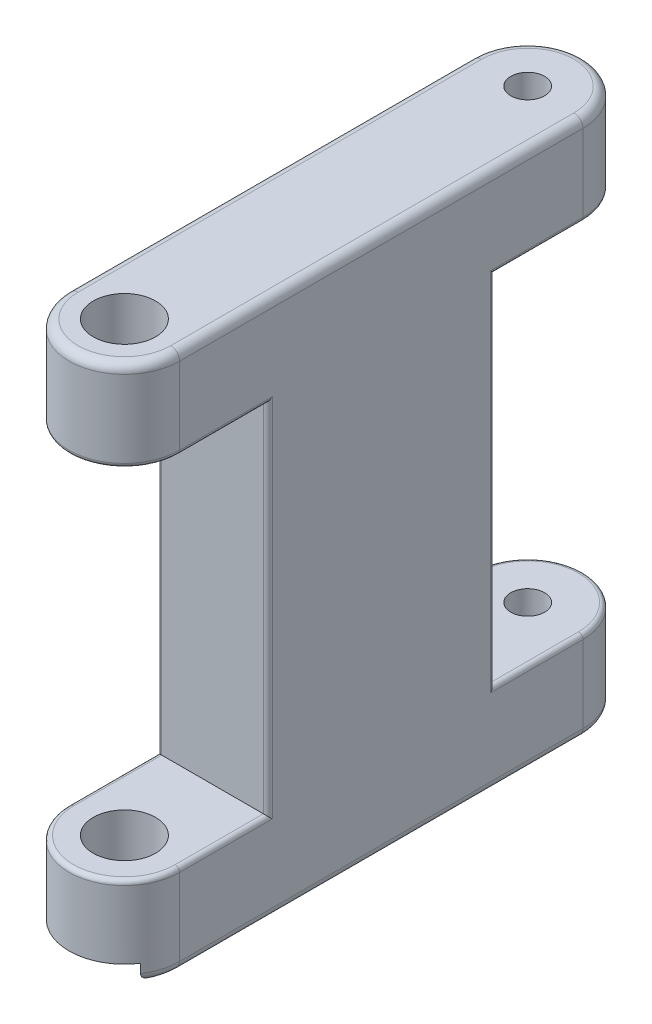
SolidWorks part; units mm, degrees
ref_plane "Front Plane" through (0, 0, 0) normal (0, 0, 1) x (1, 0, 0)
ref_plane "Top Plane" through (0, 0, 0) normal (0, 1, 0) x (1, 0, 0)
ref_plane "Right Plane" through (0, 0, 0) normal (1, 0, 0) x (0, 0, -1)
sketch "Sketch1" plane through (0, 0, 0) normal (0, 1, 0) x (1, 0, 0)
  line L0 (0, 0) -> (0, -45) construction
  line L1 (6.1688, 0) -> (6.1688, -45)
  line L2 (-6.1688, 0) -> (-6.1688, -45)
  arc A0 (6.1688, 0) -> (-6.1688, 0) centre (0, 0) ccw
  arc A1 (-6.1688, -45) -> (6.1688, -45) centre (0, -45) ccw
  point P3 (0, -22.5)
extrude "Boss-Extrude1" add sketch "Sketch1" along normal blind 60
fillet "Fillet1" radius 1 8 edges at (-6.1688, 0, 22.5) (0, 0, 51.1688) (6.1688, 0, 22.5) (0, 0, -6.1688) (6.1688, 60, 22.5) (0, 60, 51.1688) (-6.1688, 60, 22.5) (0, 60, -6.1688)
sketch "Sketch3" plane through (0, 0, 0) normal (0, -1, 0) x (1, 0, 0)
  line L0 (-5.1688, 40.9305) -> (-2.75, 20)
  line L1 (-2.75, 20) -> (2.75, 20)
  line L2 (2.75, 20) -> (5.1688, 40.9305)
  line L3 (5.1688, 45) -> (6.1688, 45) construction
  line L4 (5.1688, 40.9305) -> (5.1688, 52.629)
  line L5 (5.1688, 52.629) -> (-5.1688, 52.629)
  line L6 (-5.1688, 52.629) -> (-5.1688, 40.9305)
  line L7 (5.1688, 0) -> (5.1688, 45) construction
  dimension "D1" = 25
  dimension "D2" = 5.5
extrude "servomount" cut sketch "Sketch3" against normal blind 2
sketch "Sketch4" plane through (0, 60, 0) normal (0, 1, 0) x (1, 0, 0)
  circle A0 centre (0, 0) radius 1.8875
  circle A1 centre (0, -45) radius 3.475
extrude "holes" cut sketch "Sketch4" against normal through all
sketch "Sketch2" plane through (-6.1688, 0, 0) normal (-1, 0, 0) x (0, 0, 1)
  line L0 (0, 60) -> (45, 60) construction
  line L1 (-13.1259, 49.9) -> (9.8312, 49.9)
  line L2 (-13.1259, 49.9) -> (-13.1259, 10.1)
  line L3 (-13.1259, 10.1) -> (9.8312, 10.1)
  line L4 (9.8312, 49.9) -> (9.8312, 10.1)
  line L5 (0, 0) -> (45, 0) construction
  line L6 (-6.1688, 59) -> (-6.1688, 1) construction
  line L7 (22.5, 0) -> (22.5, 60) construction
  line L8 (0, 60) -> (45, 60) construction
  line L9 (35.1688, 49.9) -> (35.1688, 10.1)
  line L10 (58.1259, 10.1) -> (35.1688, 10.1)
  line L11 (58.1259, 49.9) -> (58.1259, 10.1)
  line L12 (58.1259, 49.9) -> (35.1688, 49.9)
  dimension "D1" = 10.1
  dimension "D2" = 10.1
  dimension "D3" = 16
extrude "space" cut sketch "Sketch2" against normal blind 50
ref_plane "Plane1" through (0, 30, 0) normal (0, 1, 0) x (1, 0, 0)
fillet "Fillet2" radius 0.5 16 edges at (0, 49.9, -6.1688) (0, 10.1, -6.1688) (0, 10.1, 51.1688) (0, 49.9, 51.1688) (-6.1688, 10.1, 40.0844) (-6.1688, 10.1, 4.9156) (-6.1688, 30, 9.8312) (-6.1688, 49.9, 4.9156) (-6.1688, 49.9, 40.0844) (-6.1688, 30, 35.1688) (6.1688, 49.9, 4.9156) (6.1688, 30, 9.8312) (6.1688, 10.1, 4.9156) (6.1688, 10.1, 40.0844) (6.1688, 30, 35.1688) (6.1688, 49.9, 40.0844)
equation "\"holesize.25in\"= .25in + .6"
equation "\"linkagelength\"= 45"
equation "\"D1@Sketch1\"=\"linkagelength\""
equation "\"holesize.125in\"= .125in + .6"
equation "\"D1@Sketch4\"=\"holesize.25in\""
equation "\"D2@Sketch4\"=\"holesize.125in\""
